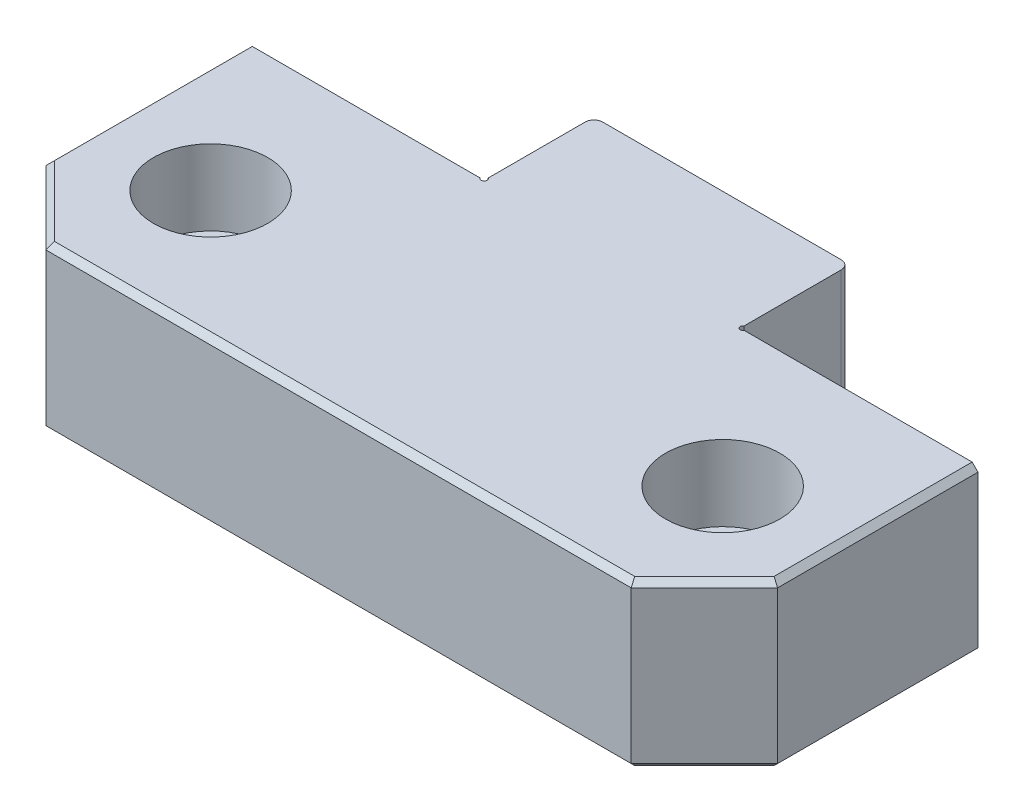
SolidWorks part; units mm, degrees
ref_plane "Front Plane" through (0, 0, 0) normal (0, 0, 1) x (1, 0, 0)
ref_plane "Top Plane" through (0, 0, 0) normal (0, 1, 0) x (1, 0, 0)
ref_plane "Right Plane" through (0, 0, 0) normal (1, 0, 0) x (0, 0, -1)
sketch "Sketch2" plane through (0, 0, 0) normal (0, 1, 0) x (1, 0, 0)
  line L0 (-22.225, 0.6939) -> (-22.225, 19.05)
  line L1 (-63.5, -47.498) -> (63.5, -47.498)
  line L2 (-63.5, -47.498) -> (-63.5, 0)
  line L3 (-63.5, 0) -> (-22.9189, 0)
  line L4 (63.5, -47.498) -> (63.5, 0)
  line L5 (-22.225, 19.05) -> (22.225, 19.05)
  line L6 (22.225, 19.05) -> (22.225, 0.6862)
  line L7 (22.9112, 0) -> (63.5, 0)
  line L8 (0, -55) -> (0, 55) construction
  line L10 (-55, 0) -> (55, 0) construction
  arc A0 (22.225, 0.6862) -> (22.9112, 0) centre (22.479, 0.254) ccw
  arc A2 (-22.9189, 0) -> (-22.225, 0.6939) centre (-22.479, 0.254) ccw
  dimension "D8" = 1.0026
  dimension "D9" = 0.254
  dimension "D12" = 1.016
  dimension "D1" = 127
  dimension "D2" = 0.254
  dimension "D3" = 63.5
  dimension "D4" = 47.498
  dimension "D5" = 19.05
  dimension "D6" = 22.225
  dimension "D7" = 44.45
  dimension "D10" = 0.254
  dimension "D11" = 0.254
extrude "Extrude1" add sketch "Sketch2" along normal blind 28.448
chamfer "Chamfer1" distance 12.7 angle 45 2 edges at (63.5, 14.224, 47.498) (-63.5, 14.224, 47.498)
sketch "Sketch4" plane through (0, 0, 0) normal (0, -1, 0) x (1, 0, 0)
  line L5 (-50.8, 47.498) -> (50.8, 47.498) construction
  line L6 (-63.5, 0) -> (-63.5, 34.798) construction
  line L7 (63.5, 34.798) -> (63.5, 0) construction
  circle A0 centre (44.45, 25.273) radius 6.7437
  circle A1 centre (-44.45, 25.273) radius 6.7437
  dimension "D5" = 13.4874
  dimension "D6" = 13.4874
  dimension "D1" = 22.225
  dimension "D2" = 19.05
  dimension "D3" = 19.05
  dimension "D4" = 22.225
extrude "Cut-Extrude2" cut sketch "Sketch4" against normal blind 15.748
sketch "Sketch5" plane through (0, 0, 0) normal (0, -1, 0) x (1, 0, 0)
  circle A1 centre (44.45, 25.273) radius 9.9187
  circle A3 centre (-44.45, 25.273) radius 9.9187
  dimension "D1" = 19.8374
  dimension "D2" = 19.8374
extrude "Cut-Extrude3" cut sketch "Sketch5" along normal blind 13.1064 from surface at -28.448
fillet "Fillet2" radius 1.524 2 edges at (-22.225, 14.224, -19.05) (22.225, 14.224, -19.05)
chamfer "Chamfer3" distance 1.016 angle 45 10 edges at (-63.5, 28.448, 17.399) (-57.15, 28.448, 41.148) (63.5, 28.448, 17.399) (57.15, 28.448, 41.148) (0, 28.448, 47.498) (-63.5, 0, 17.399) (-57.15, 0, 41.148) (0, 0, 47.498) (57.15, 0, 41.148) (63.5, 0, 17.399)
sketch "Sketch6" plane through (0, 0, 0) normal (0, -1, 0) x (1, 0, 0)
  line L0 (20.701, -19.05) -> (-20.701, -19.05) construction
  line L1 (22.225, -19.05) -> (-22.225, -19.05)
  line L2 (22.225, -0.6862) -> (22.225, -17.526) construction
  line L3 (22.225, 0) -> (22.225, -19.05)
  line L4 (-22.225, -17.526) -> (-22.225, -0.6939) construction
  line L5 (-22.225, -19.05) -> (-22.225, 0)
  line L6 (-22.9189, 0) -> (-62.484, 0) construction
  line L7 (22.225, 0) -> (-22.225, 0)
extrude "Extrude2" cut sketch "Sketch6" against normal blind 0.254
